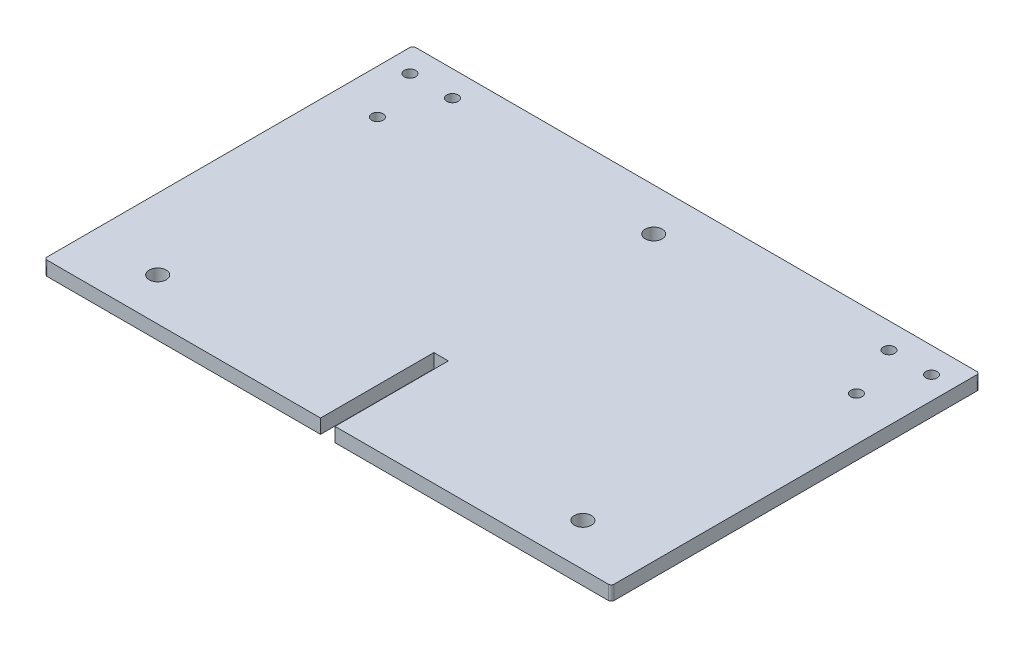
SolidWorks part; units mm, degrees
ref_plane "Front Plane" through (0, 0, 0) normal (0, 0, 1) x (1, 0, 0)
ref_plane "Top Plane" through (0, 0, 0) normal (0, 1, 0) x (1, 0, 0)
ref_plane "Right Plane" through (0, 0, 0) normal (1, 0, 0) x (0, 0, -1)
sketch "Sketch1" plane through (0, 0, 0) normal (0, 1, 0) x (1, 0, 0)
  line L0 (100, -130) -> (100, -90) construction
  line L1 (0, 0) -> (200, 0)
  line L2 (0, 0) -> (0, -130)
  line L3 (0, -130) -> (97.45, -130)
  line L4 (200, 0) -> (200, -130)
  line L6 (102.55, -130) -> (102.55, -90)
  line L7 (102.55, -90) -> (97.45, -90)
  line L8 (97.45, -130) -> (97.45, -90)
  line L10 (102.55, -130) -> (200, -130)
  circle A0 centre (8, -9) radius 2
  circle A1 centre (23, -9) radius 2
  circle A2 centre (15.5, -28) radius 2
  circle A3 centre (25, -115) radius 3
  circle A4 centre (175, -115) radius 3
  circle A5 centre (184.5, -28) radius 2
  circle A6 centre (177, -9) radius 2
  circle A7 centre (192, -9) radius 2
  circle A8 centre (100, -15) radius 3
  dimension "D3" = 4
  dimension "D4" = 4
  dimension "D5" = 4
  dimension "D7" = 19
  dimension "D8" = 7.5
  dimension "D10" = 9
  dimension "D11" = 6
  dimension "D12" = 15
  dimension "D13" = 25
  dimension "D17" = 15
  dimension "D16" = 0
  dimension "D18" = 6
  dimension "D19" = 9
  dimension "D1" = 200
  dimension "D2" = 130
  dimension "D6" = 15
  dimension "D9" = 8
  dimension "D14" = 2.55
  dimension "D15" = 40
extrude "Boss-Extrude1" add sketch "Sketch1" along normal blind 5
fillet "Fillet1" radius 1 4 edges at (0, 2.5, 0) (0, 2.5, 130) (200, 2.5, 0) (200, 2.5, 130)
